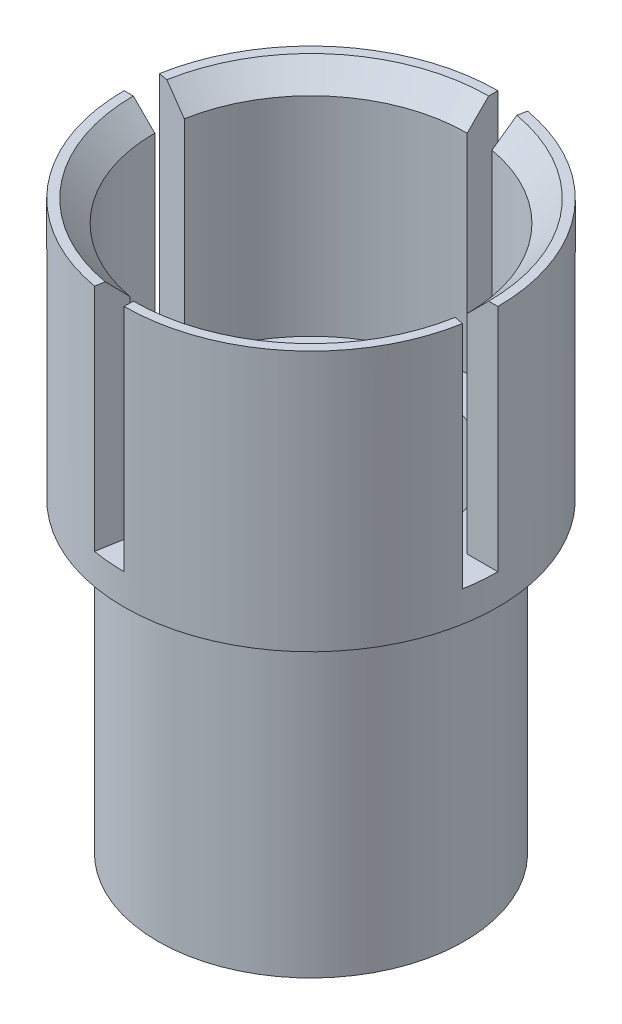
SolidWorks part; units mm, degrees
ref_plane "Front Plane" through (0, 0, 0) normal (0, 0, 1) x (1, 0, 0)
ref_plane "Top Plane" through (0, 0, 0) normal (0, 1, 0) x (1, 0, 0)
ref_plane "Right Plane" through (0, 0, 0) normal (1, 0, 0) x (0, 0, -1)
sketch "Sketch1" plane through (0, 0, 0) normal (0, 1, 0) x (1, 0, 0)
  circle A0 centre (0, 0) radius 12.7
  dimension "D1" = 25.4
extrude "Boss-Extrude1" add sketch "Sketch1" along normal blind 25.4
sketch "Sketch2" plane through (0, 25.4, 0) normal (0, 1, 0) x (1, 0, 0)
  circle A0 centre (0, 0) radius 15.494
  dimension "D1" = 30.988
extrude "Boss-Extrude2" add sketch "Sketch2" along normal blind 21.59
sketch "Sketch3" plane through (0, 46.99, 0) normal (0, 1, 0) x (1, 0, 0)
  circle A0 centre (0, 0) radius 12.954
  dimension "D1" = 25.908
extrude "Cut-Extrude1" cut sketch "Sketch3" against normal blind 19.05
sketch "Sketch4" plane through (0, 0, 0) normal (0, -1, 0) x (1, 0, 0)
  circle A0 centre (0, 0) radius 10.16
  dimension "D1" = 20.32
extrude "Cut-Extrude2" cut sketch "Sketch4" against normal blind 25.4
sketch "Sketch6" plane through (0, 25.4, 0) normal (0, -1, 0) x (1, 0, 0)
  circle A0 centre (0, 0) radius 10.16
extrude "Cut-Extrude3" cut sketch "Sketch6" against normal through all
chamfer "Chamfer1" distance 1.778 angle 45 1 edges at (0, 46.99, 12.954)
sketch "Sketch7" plane through (0, 0, 0) normal (1, 0, 0) x (0, 0, -1)
  line L0 (-12.954, 27.94) -> (-12.954, 72.9495)
  line L1 (-12.954, 27.94) -> (-57.3415, 27.94)
  line L2 (-12.954, 72.9495) -> (-57.3415, 72.9495)
  line L3 (-57.3415, 27.94) -> (-57.3415, 72.9495)
revolve "Cut-Revolve1" cut sketch "Sketch7" angle 10 about axis through (0, 46.99, 0) along (0, -1, 0)
pattern_circular "CirPattern1" count 4 over 360 about axis through (0, 25.4, 0) along (0, -1, 0) of "Cut-Revolve1"
